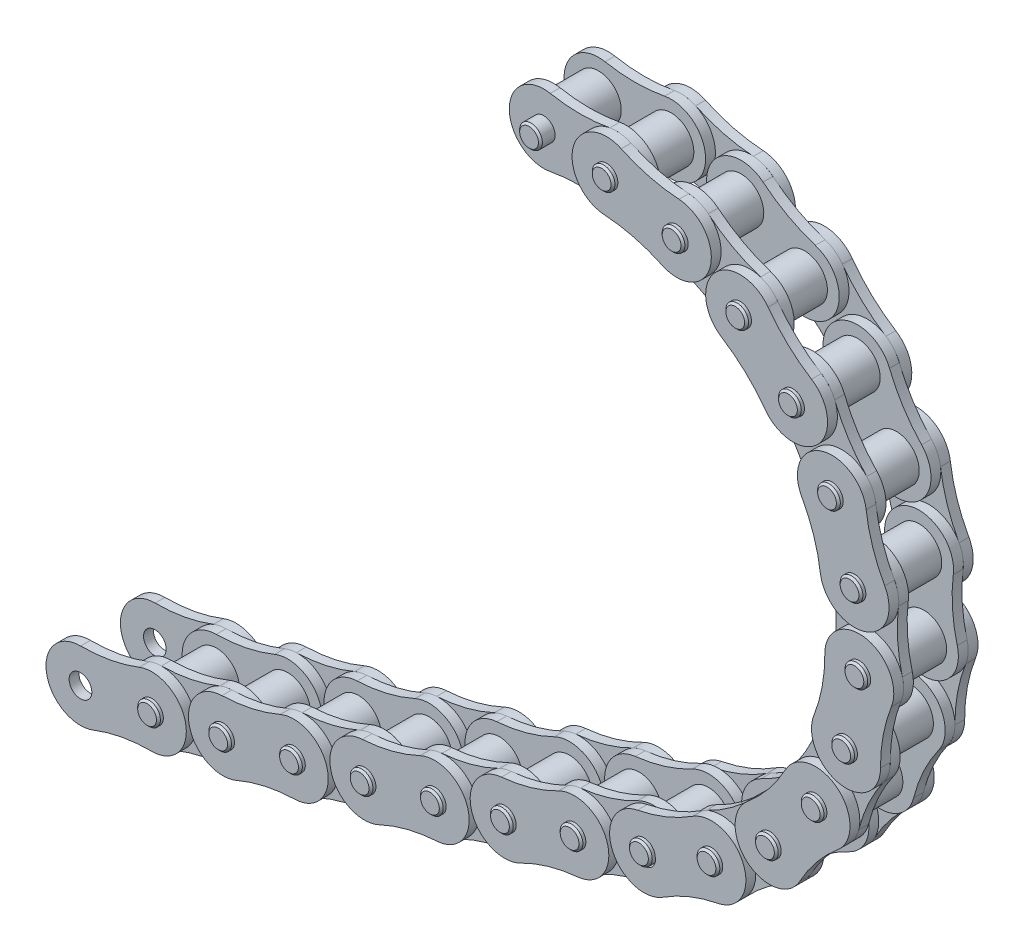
SolidWorks part; units mm, degrees
ref_plane "前视基准面" through (0, 0, 0) normal (0, 0, 1) x (1, 0, 0)
ref_plane "上视基准面" through (0, 0, 0) normal (0, 1, 0) x (1, 0, 0)
ref_plane "右视基准面" through (0, 0, 0) normal (1, 0, 0) x (0, 0, -1)
sketch "草图1" plane through (0, 0, 0) normal (0, 0, 1) x (1, 0, 0)
  line L0 (-12.7, 0) -> (12.7, 0) construction
  line L1 (0, 10.8585) -> (0, -10.8585) construction
  line L2 (12.7, 0) -> (35.31, 0) construction
  line L3 (35.31, 0) -> (51.06, 0) construction
  circle A0 centre (-12.7, 0) radius 12.065
  circle A1 centre (12.7, 0) radius 12.065
  circle A2 centre (0, 66.2389) radius 55.3804
  circle A3 centre (0, -66.2389) radius 55.3804
  circle A4 centre (-12.7, 0) radius 7.94
  circle A5 centre (12.7, 0) radius 7.94
  circle A6 centre (-12.7, 0) radius 3.97
  circle A7 centre (12.7, 0) radius 3.97
  dimension "h2" = 24.13
  dimension "d1" = 15.88
  dimension "d2" = 7.94
  dimension "p" = 25.4
  dimension "h3" = 21.717
  dimension "b2" = 22.61
  dimension "b1" = 15.75
sketch "草图2" plane through (0, 0, 0) normal (0, 0, 1) x (1, 0, 0)
  circle A0 centre (12.7, 0) radius 7.94 construction
  circle A1 centre (-12.7, 0) radius 7.94 construction
  circle A2 centre (12.7, 0) radius 7.94
  circle A3 centre (-12.7, 0) radius 7.94
extrude "拉伸1" add sketch "草图2" along normal mid plane 15.75
sketch "草图3" plane through (0, 0, 7.875) normal (0, 0, 1) x (1, 0, 0)
  circle A0 centre (-12.7, 0) radius 12.065 construction
  arc A1 (-10.4282, 11.8492) -> (-10.4282, -11.8492) centre (-12.7, 0) ccw
  circle A2 centre (12.7, 0) radius 12.065 construction
  arc A3 (10.4282, -11.8492) -> (10.4282, 11.8492) centre (12.7, 0) ccw
  circle A4 centre (0, 66.2389) radius 55.3804 construction
  arc A5 (-10.4282, 11.8492) -> (10.4282, 11.8492) centre (0, 66.2389) ccw
  circle A6 centre (0, -66.2389) radius 55.3804 construction
  arc A7 (10.4282, -11.8492) -> (-10.4282, -11.8492) centre (0, -66.2389) ccw
extrude "拉伸2" add sketch "草图3" along normal blind 3.43
sketch "草图4" plane through (0, 0, 11.305) normal (0, 0, 1) x (1, 0, 0)
  circle A0 centre (12.7, 0) radius 3.97 construction
  circle A1 centre (-12.7, 0) radius 3.97 construction
  circle A2 centre (12.7, 0) radius 3.97
  circle A3 centre (-12.7, 0) radius 3.97
extrude "拉伸3" add sketch "草图4" along normal blind 5.145
chamfer "倒角1" distance 0.686 angle 45 2 edges at (16.67, 0, 16.45) (-8.73, 0, 16.45)
mirror "镜向1" about plane through (0, 0, 0) normal (0, 0, 1) of "拉伸2", "倒角1", "拉伸3"
sketch "草图5" plane through (0, 0, 0) normal (0, 0, 1) x (1, 0, 0)
  line L0 (12.7, 0) -> (37.302, -6.3167) construction
  line L1 (-12.7, 0) -> (12.7, 0) construction
  line L2 (-12.7, 0) -> (-776.8532, -96.535)
  line L4 (0, -100.5309) -> (-768.1907, -165.1058) construction
  line L5 (37.302, -6.3167) -> (59.5602, -18.5533) construction
  arc A0 (30.9597, -197.0153) -> (-12.7, 0) centre (0, -100.5309) ccw
  arc A1 (-776.8532, -96.535) -> (-783.5035, -232.504) centre (-768.1907, -165.1058) ccw
  arc A2 (-783.5035, -232.504) -> (30.9597, -197.0153) centre (-441.1553, 1274.3085) ccw
  dimension "R2" = 202.6597
  dimension "R1" = 138.2317
  dimension "a" = 770.9
  dimension "La" = 770.2266
  dimension "L2" = 299.6078
  dimension "L" = 825
  dimension "L1" = 193.0074
curve "组合曲线1"
sketch "草图6" plane through (0, 0, 11.305) normal (0, 0, 1) x (1, 0, 0)
  arc A0 (32.1548, -17.2286) -> (38.0483, 5.7252) centre (37.302, -6.3167) ccw
  circle A1 centre (12.7, 0) radius 12.065 construction
  arc A2 (17.8472, 10.9119) -> (11.9537, -12.0419) centre (12.7, 0) ccw
  arc A3 (17.8472, 10.9119) -> (38.0483, 5.7252) centre (41.4739, 60.9995) ccw
  arc A4 (11.9537, -12.0419) -> (32.1548, -17.2286) centre (8.5281, -67.3162) cw
  circle A5 centre (0, 66.2389) radius 55.3804 construction
  circle A6 centre (0, -66.2389) radius 55.3804 construction
  circle A7 centre (12.7, 0) radius 3.97 construction
  circle A8 centre (12.7, 0) radius 3.97
  circle A9 centre (37.302, -6.3167) radius 3.97
extrude "拉伸4" add sketch "草图6" along normal blind 3.43 separate body
mirror "镜向2" about plane through (0, 0, 0) normal (0, 0, 1)
pattern_curve "曲线阵列1" parameters "D1"=10, "D3"=50.8, "D2"=1, "D4"=50
pattern_curve "曲线阵列4" parameters "D1"=10, "D3"=50.8, "D2"=1, "D4"=50
equation "\"D1@拉伸2\" = (  \"b2@草图1\" - \"D1@拉伸1\" )  / 2"
equation "\"D1@拉伸3\" = \"D1@拉伸2\" * 1.5"
equation "\"D1@倒角1\" = \"D1@拉伸2\" / 5"
equation "\"D1@拉伸1\" = \"b1@草图1\""
equation "\"h3@草图1\" = \"h2@草图1\" * 0.9"
equation "\"D1@拉伸4\" = \"D1@拉伸2\""
equation "\"D3@曲线阵列1\" =\"p@草图1\" * 2"
equation "\"D3@曲线阵列4\" = \"p@草图1\" * 2"
equation "\"D1@曲线阵列4\" = \"D1@曲线阵列1\""
